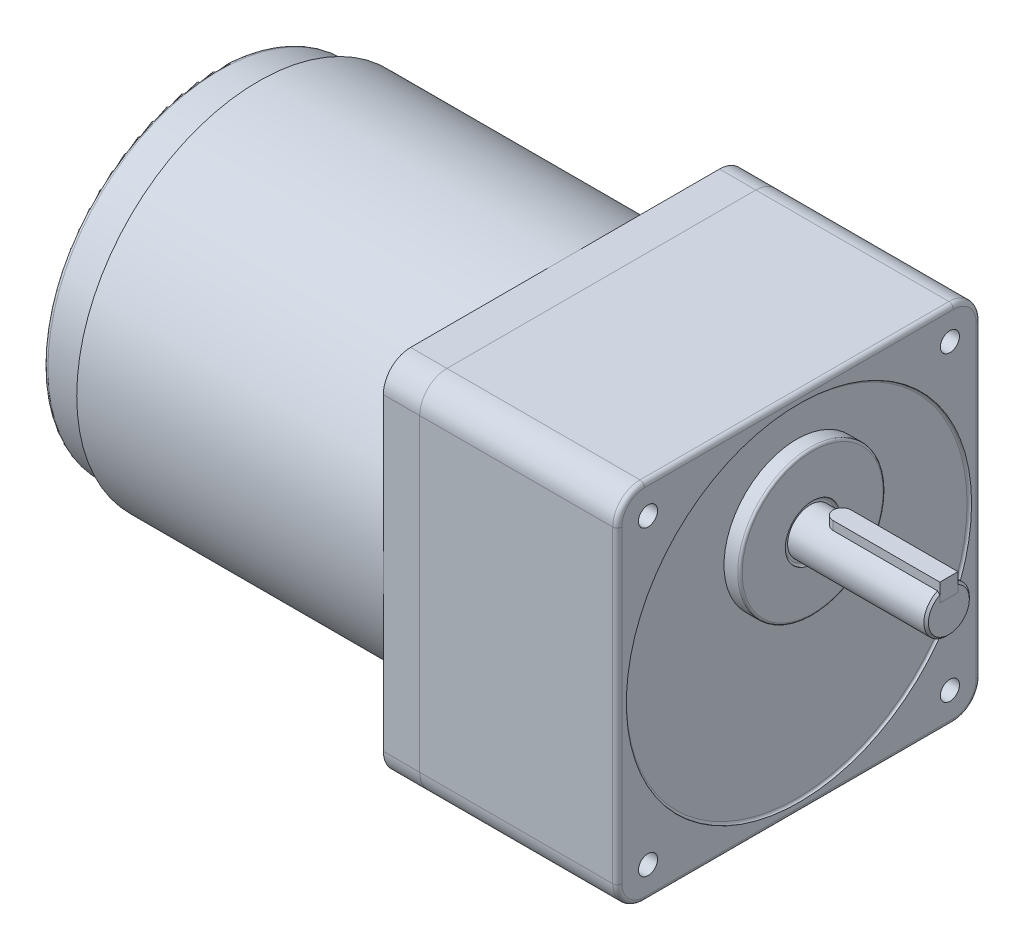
SolidWorks part; units mm, degrees
ref_plane "前视基准面" through (0, 0, 0) normal (0, 0, 1) x (1, 0, 0)
ref_plane "上视基准面" through (0, 0, 0) normal (0, 1, 0) x (1, 0, 0)
ref_plane "右视基准面" through (0, 0, 0) normal (1, 0, 0) x (0, 0, -1)
sketch "草图1" plane through (0, 0, 0) normal (1, 0, 0) x (0, 0, -1)
  line L1 (-34, -40) -> (34, -40)
  line L2 (-40, -34) -> (-40, 34)
  line L3 (-34, 40) -> (34, 40)
  line L4 (40, -34) -> (40, 34)
  line L5 (-40, -40) -> (40, 40) construction
  line L6 (-40, 40) -> (40, -40) construction
  arc A0 (-34, -40) -> (-40, -34) centre (-34, -34) cw
  arc A1 (34, -40) -> (40, -34) centre (34, -34) ccw
  arc A2 (34, 40) -> (40, 34) centre (34, 34) cw
  arc A3 (-40, 34) -> (-34, 40) centre (-34, 34) cw
  point P0 (0, 0)
  dimension "D1" = 6
extrude "凸台-拉伸1" add sketch "草图1" against normal blind 43.5
sketch "草图2" plane through (-43.5, 0, 0) normal (-1, 0, 0) x (0, 0, 1)
  line L0 (-34, 40) -> (34, 40) construction
  line L1 (-34, -40) -> (34, -40)
  line L2 (-40, -34) -> (-40, 34)
  line L3 (-34, 40) -> (34, 40)
  line L4 (40, -34) -> (40, 34)
  line L5 (-40, -40) -> (40, 40) construction
  line L6 (-40, 40) -> (40, -40) construction
  arc A0 (-34, -40) -> (-40, -34) centre (-34, -34) cw
  arc A1 (34, -40) -> (40, -34) centre (34, -34) ccw
  arc A2 (34, 40) -> (40, 34) centre (34, 34) cw
  arc A3 (-40, 34) -> (-34, 40) centre (-34, 34) cw
  point P0 (0, 0)
  dimension "D1" = 6
extrude "凸台-拉伸2" add sketch "草图2" along normal blind 8 separate body
sketch "草图3" plane through (-51.5, 0, 0) normal (-1, 0, 0) x (0, 0, 1)
  circle A0 centre (0, 0) radius 40
extrude "凸台-拉伸3" add sketch "草图3" along normal blind 67.5
sketch "草图4" plane through (-119, 0, 0) normal (-1, 0, 0) x (0, 0, 1)
  circle A0 centre (0, 0) radius 37.85
extrude "凸台-拉伸4" add sketch "草图4" along normal blind 9.5
fillet "圆角1" radius 1 1 edges at (-128.5, 0, 37.85)
fillet "圆角2" radius 1 8 edges at (0, 0, 40) (0, 38.2426, 38.2426) (0, 40, 0) (0, 38.2426, -38.2426) (0, 0, -40) (0, -38.2426, -38.2426) (0, -40, 0) (0, -38.2426, 38.2426)
sketch "草图5" plane through (0, 0, 0) normal (1, 0, 0) x (0, 0, -1)
  point P10 (-33.234, 33.234)
  point P11 (33.234, 33.234)
  point P12 (33.234, -33.234)
  point P13 (-33.234, -33.234)
hole_wizard "M5 螺纹孔1" positions "3D草图1" profile "草图6" tap size "M5" standard "GB"
sketch3d "3D草图1"
  point P0 (0, 33.234, 33.234)
  point P3 (0, -33.234, 33.234)
  point P6 (0, -33.234, -33.234)
  point P9 (0, 33.234, -33.234)
sketch "草图6" plane through (0, 33.234, 33.234) normal (0, 1, 0) x (0, 0, -1)
  line L0 (0, 0) -> (0, 15.2618)
  line L1 (0, 15.2618) -> (2.1, 14)
  line L2 (2.1, 14) -> (2.1, 0)
  line L5 (2.1, 0) -> (0, 0)
  line L10 (0, 15.2618) -> (-2.1, 14) construction
  line L11 (0, -6.35) -> (0, 107.95) construction
  dimension "螺纹孔钻头直径" = 4.2
  dimension "螺纹孔钻头深度" = 14
  dimension "导头角度" = 118
sketch "草图7" plane through (0, 0, 0) normal (1, 0, 0) x (0, 0, -1)
  circle A0 centre (0, 0) radius 38
extrude "切除-拉伸1" cut sketch "草图7" against normal blind 0.5
fillet "圆角3" radius 0.5 1 edges at (-0.5, 0, -38)
sketch "草图8" plane through (-0.5, 0, 0) normal (1, 0, 0) x (0, 0, -1)
  circle A0 centre (0, 15) radius 16
extrude "凸台-拉伸5" add sketch "草图8" along normal blind 3.5
fillet "圆角4" radius 0.5 1 edges at (3, 15, -16)
sketch "草图9" plane through (3, 0, 0) normal (1, 0, 0) x (0, 0, -1)
  circle A0 centre (0, 15) radius 6
extrude "切除-拉伸2" cut sketch "草图9" against normal blind 0.5
fillet "圆角5" radius 0.5 1 edges at (2.5, 15, -6)
sketch "草图10" plane through (2.5, 0, 0) normal (1, 0, 0) x (0, 0, -1)
  circle A0 centre (0, 15) radius 5
extrude "凸台-拉伸6" add sketch "草图10" along normal blind 30.5
ref_plane "基准面1" through (0, 20, 0) normal (0, 1, 0) x (1, 0, 0)
sketch "草图11" plane through (0, 20, 0) normal (0, 1, 0) x (1, 0, 0)
  line L1 (33, -5) -> (33, 5) construction
  line L2 (9.5, 2) -> (33, 2)
  line L3 (33, 2) -> (33, -2)
  line L4 (33, -2) -> (9.5, -2)
  arc A0 (9.5, 2) -> (9.5, -2) centre (9.5, 0) ccw
extrude "切除-拉伸3" cut sketch "草图11" against normal blind 2.5
sketch "草图12" plane through (0, 17.5, 0) normal (0, 1, 0) x (1, 0, 0)
  line L0 (9.5, 2) -> (33, 2)
  line L1 (33, 2) -> (33, -2)
  line L2 (33, -2) -> (9.5, -2)
  arc A0 (9.5, 2) -> (9.5, -2) centre (9.5, 0) ccw
extrude "凸台-拉伸7" add sketch "草图12" along normal blind 4 separate body
chamfer "倒角1" distance 0.5 angle 45 1 edges at (33, 10, 0)
